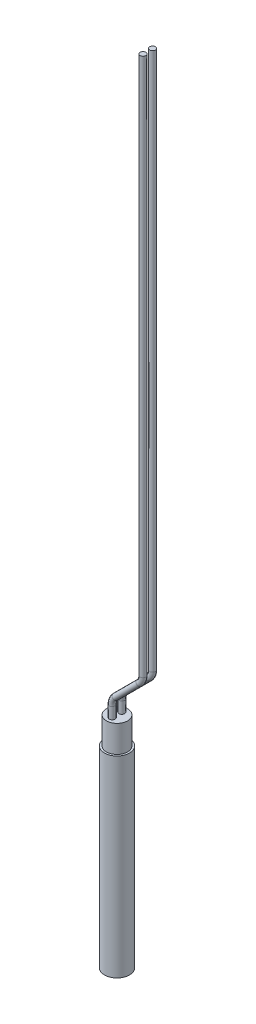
SolidWorks part; units mm, degrees
ref_plane "Plan1" through (0, 0, 0) normal (0, 0, 1) x (1, 0, 0)
ref_plane "Plan2" through (0, 0, 0) normal (0, 1, 0) x (1, 0, 0)
ref_plane "Plan3" through (0, 0, 0) normal (1, 0, 0) x (0, 0, -1)
sketch "Esquisse1" plane through (0, 0, 0) normal (0, 0, 1) x (1, 0, 0)
  line L0 (0, 92.1474) -> (0, -4.7386) construction
  line L1 (0, -3.575) -> (0, 3.575) construction
  line L2 (3.575, 0) -> (-3.575, 0) construction
  line L3 (2.75, 50) -> (3.25, 50)
  line L4 (0, 57) -> (0, 0)
  line L5 (0, 0) -> (3.25, 0)
  line L6 (3.25, 50) -> (3.25, 0)
  line L7 (2.75, 50) -> (2.75, 57)
  line L8 (2.75, 57) -> (0, 57)
  dimension "D1" = 6.5
  dimension "D2" = 50
  dimension "D3" = 0.5
  dimension "D4" = 7
revolve "Révolution1" add sketch "Esquisse1" angle 360 about L0
sketch "Esquisse2" plane through (0, 0, 0) normal (0, 0, 1) x (1, 0, 0)
  line L0 (0, 57) -> (0, 60)
  line L1 (2.75, 57) -> (-2.75, 57) construction
  line L2 (0.8787, 62.1213) -> (7.1213, 68.364)
  line L3 (8, 70.4853) -> (8, 210.4853)
  arc A0 (8, 70.4853) -> (7.1213, 68.364) centre (5, 70.4853) cw
  arc A1 (0.8787, 62.1213) -> (0, 60) centre (3, 60) ccw
  dimension "D2" = 3
  dimension "D1" = 8
  dimension "D3" = 3
  dimension "D4" = 45
  dimension "D5" = 140
sketch "Esquisse3" plane through (0, 57, 0) normal (0, 1, 0) x (1, 0, 0)
  line L0 (0, 1.25) -> (0, -1.25) construction
  circle A0 centre (0, 1.25) radius 0.75
  circle A1 centre (0, -1.25) radius 0.75
  dimension "D1" = 2.5
  dimension "D2" = 1.5
sweep "Balayage1" add profiles "Esquisse3" path "Esquisse2"
